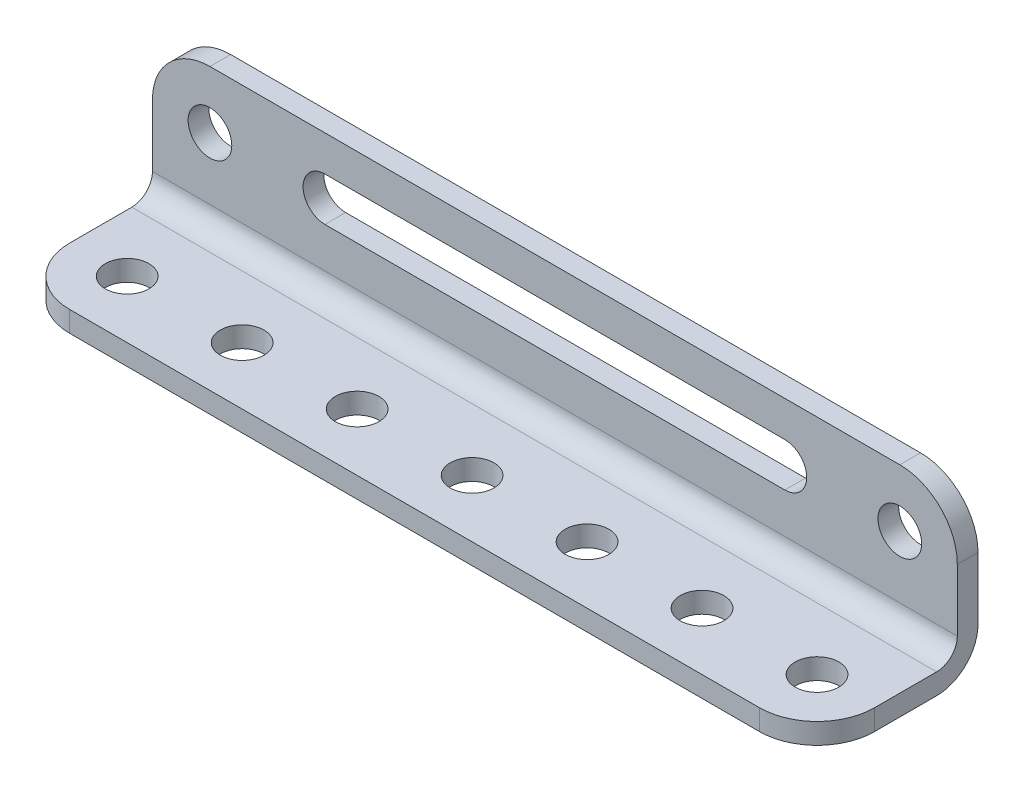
SolidWorks part; units mm, degrees
ref_plane "Front" through (0, 0, 0) normal (0, 0, 1) x (1, 0, 0)
ref_plane "Top" through (0, 0, 0) normal (0, 1, 0) x (1, 0, 0)
ref_plane "Right" through (0, 0, 0) normal (1, 0, 0) x (0, 0, -1)
sketch "Sketch1" plane through (0, 0, 0) normal (1, 0, 0) x (0, 0, -1)
  line L0 (0, 0) -> (17.78, 0)
  line L1 (17.78, 0) -> (17.78, 17.78)
  dimension "D1" = 17.78
extrude "Extrude-Thin1" add sketch "Sketch1" along normal mid plane 88.9 thin
sketch "Sketch2" plane through (0, 2.286, 0) normal (0, 1, 0) x (-1, 0, 0)
  line L0 (-44.45, 0) -> (44.45, 0) construction
  circle A0 centre (38.1, -6.35) radius 2.413
  dimension "D3" = 4.826
  dimension "D1" = 38.1
  dimension "D2" = 6.35
extrude "Cut-Extrude1" cut sketch "Sketch2" against normal through all
pattern_linear "LPattern1" count 7 spacing 12.7
fillet "Fillet1" radius 6.35
sketch "Sketch3" plane through (0, 0, -15.494) normal (0, 0, 1) x (1, 0, 0)
  line L0 (38.1, 17.78) -> (-38.1, 17.78) construction
  circle A0 centre (-38.1, 11.43) radius 2.413
  dimension "D2" = 4.826
  dimension "D1" = 38.1
  dimension "D3" = 6.35
extrude "Cut-Extrude2" cut sketch "Sketch3" against normal through all
pattern_linear "LPattern2" count 3 spacing 76.2
sketch "Sketch4" plane through (0, 0, -15.494) normal (0, 0, 1) x (1, 0, 0)
  line L0 (0, 0) -> (0, 13.843) construction
  line L2 (0, 0) -> (0, 2.286) construction
  line L3 (38.1, 11.43) -> (-38.1, 11.43) construction
  line L4 (-25.4, 13.843) -> (25.4, 13.843)
  line L6 (-25.4, 9.017) -> (25.4, 9.017)
  arc A0 (25.4, 13.843) -> (25.4, 9.017) centre (25.4, 11.43) cw
  arc A1 (-25.4, 13.843) -> (-25.4, 9.017) centre (-25.4, 11.43) ccw
  circle A3 centre (38.1, 11.43) radius 2.413 construction
  dimension "D1" = 50.8
extrude "Cut-Extrude3" cut sketch "Sketch4" against normal through all
